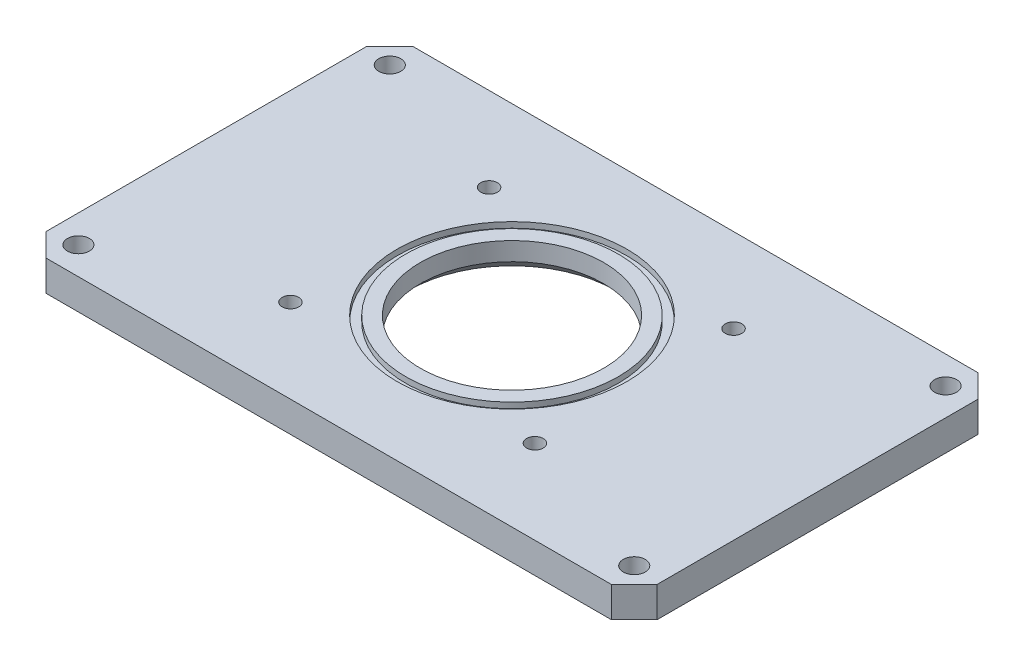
SolidWorks part; units mm, degrees
ref_plane "Front Plane" through (0, 0, 0) normal (0, 0, 1) x (1, 0, 0)
ref_plane "Top Plane" through (0, 0, 0) normal (0, 1, 0) x (1, 0, 0)
ref_plane "Right Plane" through (0, 0, 0) normal (1, 0, 0) x (0, 0, -1)
sketch "Sketch1" plane through (0, 0, 0) normal (0, 1, 0) x (1, 0, 0)
  line L1 (-63.5, -38.1) -> (63.5, -38.1)
  line L2 (-63.5, -38.1) -> (-63.5, 38.1)
  line L3 (-63.5, 38.1) -> (63.5, 38.1)
  line L4 (63.5, -38.1) -> (63.5, 38.1)
  line L5 (-63.5, -38.1) -> (63.5, 38.1) construction
  line L6 (-63.5, 38.1) -> (63.5, -38.1) construction
  point P0 (0, 0)
  dimension "D1" = 127
  dimension "D2" = 76.2
extrude "Boss-Extrude1" add sketch "Sketch1" along normal mid plane 6.35
chamfer "Chamfer1" distance 4.7625 angle 45 4 edges at (-63.5, 0, -38.1) (63.5, 0, -38.1) (63.5, 0, 38.1) (-63.5, 0, 38.1)
sketch "Sketch7" plane through (0, 3.175, 0) normal (0, 1, 0) x (1, 0, 0)
  line L0 (-61.1187, 35.7188) -> (-57.7512, 32.3512) construction
  line L1 (-58.7375, 38.1) -> (-63.5, 33.3375) construction
  circle A1 centre (-57.7512, 32.3512) radius 2.286
  dimension "D1" = 4.572
  dimension "D2" = 4.7625
extrude "Cut-Extrude1" cut sketch "Sketch7" against normal through all both and the other way through all
mirror "Mirror4" about plane through (0, 0, 0) normal (1, 0, 0) of "Cut-Extrude1"
mirror "Mirror5" about plane through (0, 0, 0) normal (0, 0, 1) of "Mirror4", "Cut-Extrude1"
sketch "Sketch12" plane through (0, -3.175, 0) normal (0, -1, 0) x (1, 0, 0)
  circle A0 centre (0, 0) radius 19.05
  dimension "D1" = 38.1
extrude "Cut-Extrude2" cut sketch "Sketch12" against normal through all both and the other way through all contours A0
chamfer "Chamfer2" distance 2.54 angle 45 1 edges at (0, -3.175, -19.05)
sketch "Sketch19" plane through (0, 3.175, 0) normal (0, 1, 0) x (1, 0, 0)
  line L1 (-25.4, -20.6375) -> (25.4, -20.6375) construction
  line L2 (-25.4, -20.6375) -> (-25.4, 20.6375) construction
  line L3 (-25.4, 20.6375) -> (25.4, 20.6375) construction
  line L4 (25.4, -20.6375) -> (25.4, 20.6375) construction
  line L5 (-25.4, -20.6375) -> (25.4, 20.6375) construction
  line L6 (-25.4, 20.6375) -> (25.4, -20.6375) construction
  point P0 (0, 0)
  dimension "D1" = 50.8
  dimension "D2" = 41.275
hole_wizard "Tap Drill for #8-32 Tap1" positions "3DSketch1" profile "Sketch20" hole size "#8-32" standard "ANSI Inch"
sketch3d "3DSketch1"
  point P0 (-25.4, 3.175, -20.6375)
  point P3 (25.4, 3.175, -20.6375)
  point P6 (25.4, 3.175, 20.6375)
  point P9 (-25.4, 3.175, 20.6375)
sketch "Sketch20" plane through (-25.4, 3.175, -20.6375) normal (1, 0, 0) x (0, 0, 1)
  line L0 (0, 0) -> (0, 4.8478)
  line L1 (0, 4.8478) -> (1.7272, 3.81)
  line L2 (1.7272, 3.81) -> (1.7272, 0)
  line L5 (1.7272, 0) -> (0, 0)
  line L10 (0, 4.8478) -> (-1.7272, 3.81) construction
  line L11 (0, -6.35) -> (0, 107.95) construction
  dimension "Hole Dia." = 3.4544
  dimension "Hole Depth" = 3.81
  dimension "Drill Angle" = 118
sketch "Sketch21" plane through (0, 0, 0) normal (0, 0, 1) x (1, 0, 0)
  line L0 (0, 0) -> (0, 3.175) construction
  line L1 (-58.7375, 3.175) -> (58.7375, 3.175) construction
  line L2 (22.0853, 3.175) -> (22.0853, 1.9844)
  line L3 (22.0853, 1.9844) -> (23.8633, 1.9844)
  line L4 (23.8633, 1.9844) -> (23.8633, 3.175)
  line L5 (23.8633, 3.175) -> (22.0853, 3.175)
  dimension "D1" = 1.1906
  dimension "D2" = 23.8633
  dimension "D3" = 22.0853
revolve "Cut-Revolve1" cut sketch "Sketch21" angle 360 about L0
